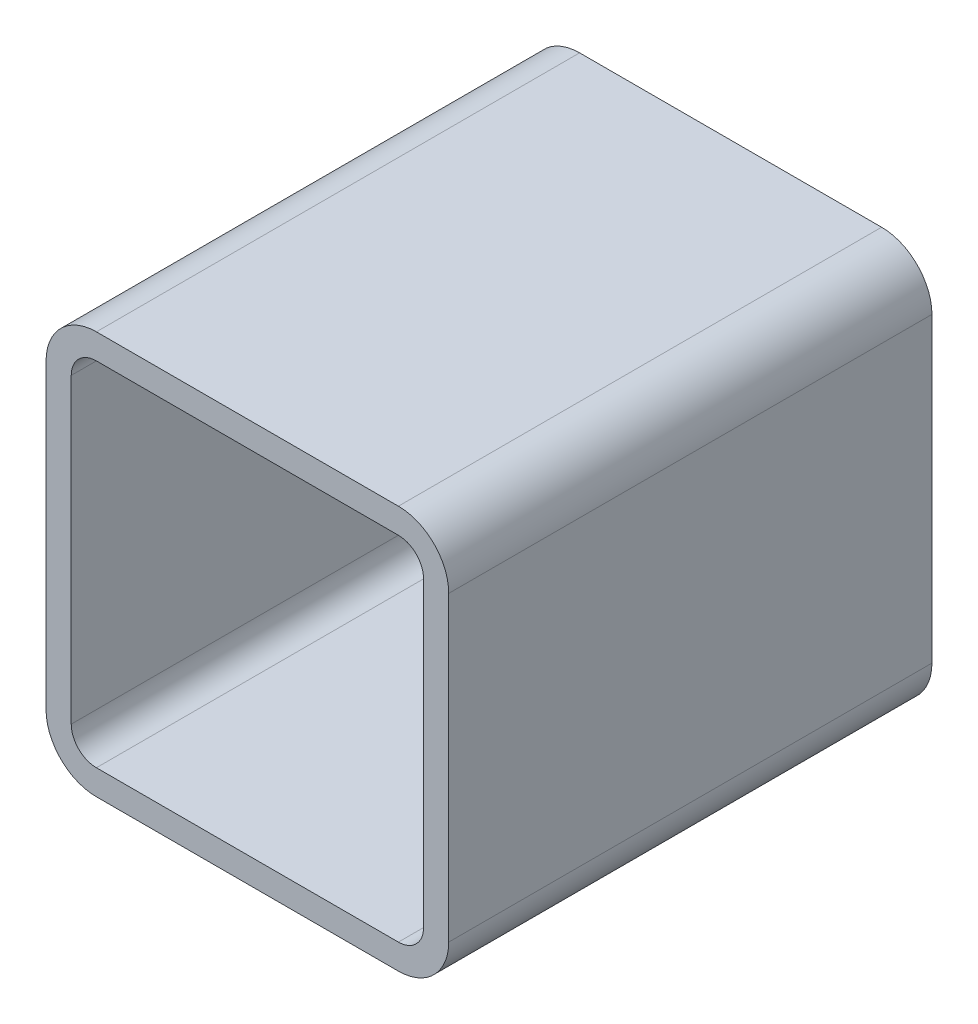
SolidWorks part; units mm, degrees
ref_plane "Front Plane" through (0, 0, 0) normal (0, 0, 1) x (1, 0, 0)
ref_plane "Top Plane" through (0, 0, 0) normal (0, 1, 0) x (1, 0, 0)
ref_plane "Right Plane" through (0, 0, 0) normal (1, 0, 0) x (0, 0, -1)
sketch "Sketch1" plane through (0, 0, 0) normal (0, 0, 1) x (1, 0, 0)
sketch_block_instance "HSS10x10x0.625-1"
sketch_block "HSS10x10x0.625"
extrude "Boss-Extrude1" add sketch "Sketch1" along normal blind 304.8
